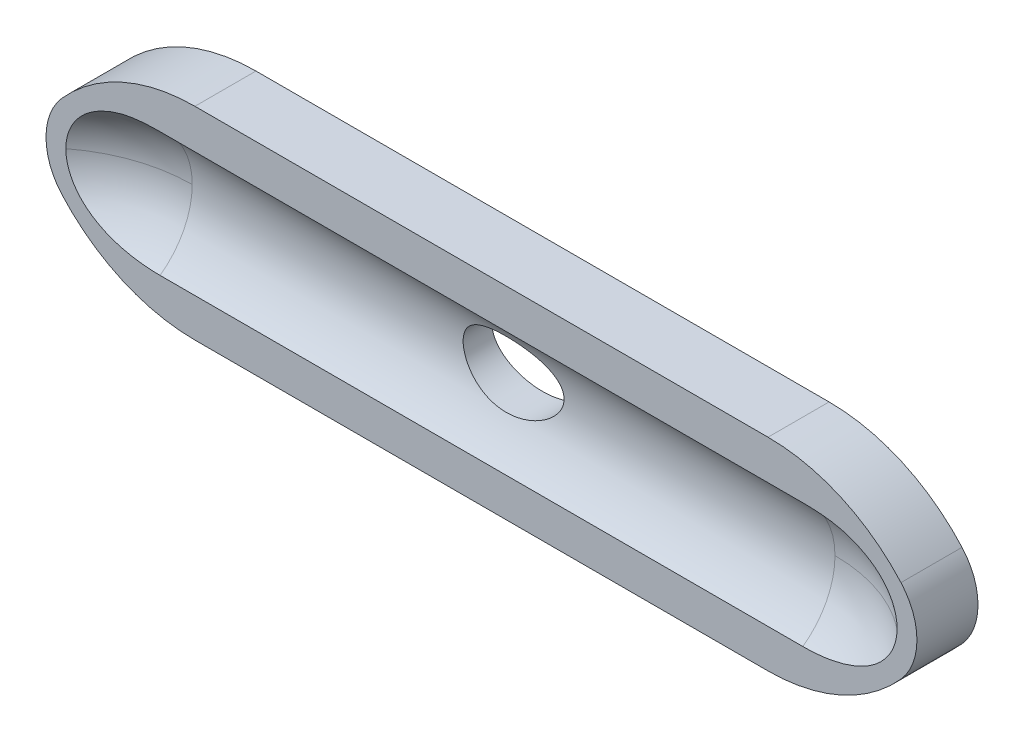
SolidWorks part; units mm, degrees
ref_plane "Front Plane" through (0, 0, 0) normal (0, 0, 1) x (1, 0, 0)
ref_plane "Top Plane" through (0, 0, 0) normal (0, 1, 0) x (1, 0, 0)
ref_plane "Right Plane" through (0, 0, 0) normal (1, 0, 0) x (0, 0, -1)
sketch "Sketch1" plane through (0, 0, 0) normal (0, 0, 1) x (1, 0, 0)
  line L17 (-22.2918, 27.0645) -> (22.2918, 27.0645)
  line L18 (22.2918, 42.8145) -> (-22.2918, 42.8145)
  line L19 (22.2918, 42.8145) -> (-22.2918, 42.8145)
  arc A45 (-32.6336, 31.6895) -> (-22.2918, 27.0645) centre (-22.2918, 40.9395) ccw
  arc A46 (-32.6336, 38.1895) -> (-32.6336, 31.6895) centre (-29, 34.9395) ccw
  arc A47 (-22.2918, 42.8145) -> (-32.6336, 38.1895) centre (-22.2918, 28.9395) ccw
  arc A48 (22.2918, 27.0645) -> (32.6336, 31.6895) centre (22.2918, 40.9395) ccw
  arc A49 (32.6336, 31.6895) -> (32.6336, 38.1895) centre (29, 34.9395) ccw
  arc A50 (32.6336, 38.1895) -> (22.2918, 42.8145) centre (22.2918, 28.9395) ccw
  arc A51 (-32.6336, 31.6895) -> (-22.2918, 27.0645) centre (-22.2918, 40.9395) ccw
  arc A52 (-32.6336, 38.1895) -> (-32.6336, 31.6895) centre (-29, 34.9395) ccw
  arc A53 (-22.2918, 42.8145) -> (-32.6336, 38.1895) centre (-22.2918, 28.9395) ccw
  arc A54 (22.2918, 27.0645) -> (32.6336, 31.6895) centre (22.2918, 40.9395) ccw
  arc A55 (32.6336, 31.6895) -> (32.6336, 38.1895) centre (29, 34.9395) ccw
  arc A56 (32.6336, 38.1895) -> (22.2918, 42.8145) centre (22.2918, 28.9395) ccw
  ellipse E0 centre (0, 34.9395) end of major axis (-3.925, 34.9395) minor radius 2.5625 construction
  ellipse E1 centre (0, 34.9395) end of major axis (-3.925, 34.9395) minor radius 2.5625
  dimension "D1" = 0.125
extrude "Boss-Extrude1" add sketch "Sketch1" against normal blind 4.75
other "Cavity1"
other "mock iphone<1>@charging stand assem1"
sketch "Sketch4" plane through (0, 0, 0) normal (1, 0, 0) x (0, 0, -1)
  line L0 (0, 30.0661) -> (0, 39.7479)
  arc A0 (0, 30.0661) -> (2.5, 34.9395) centre (-3.5, 34.9395) ccw construction
  arc A1 (2.5, 34.9395) -> (0.4686, 39.4395) centre (-3.5, 34.9395) ccw construction
  arc A2 (0.4686, 39.4395) -> (0, 39.7479) centre (-0.8542, 37.9395) ccw construction
  arc A3 (0, 30.0661) -> (2.5, 34.9395) centre (-3.5, 34.9395) ccw
  arc A4 (2.5, 34.9395) -> (0.4686, 39.4395) centre (-3.5, 34.9395) ccw
  arc A5 (0.4686, 39.4395) -> (0, 39.7479) centre (-0.8542, 37.9395) ccw
extrude "Cut-Extrude1" cut sketch "Sketch4" against normal mid plane 20
sketch "Sketch5" plane through (0, 0, -4.75) normal (0, 0, -1) x (-1, 0, 0)
  circle A0 centre (29, 34.9395) radius 10
  circle A1 centre (-29, 34.9395) radius 10
  dimension "D1" = 20
extrude "Boss-Extrude2" [suppressed] add sketch "Sketch5" against normal blind 0.35
sketch "Sketch6" [suppressed] plane through (0, 0, -4.4) normal (0, 0, 1) x (1, 0, 0)
  line L0 (-28.6657, 34.9395) -> (-38.6657, 34.9395)
  line L2 (-28.6657, 34.9395) -> (-35.7368, 27.8684)
  line L3 (-28.6657, 34.9395) -> (-35.7368, 42.0106)
  line L4 (-28.3122, 35.2931) -> (-35.3832, 42.3641)
  line L5 (-28.6657, 35.4395) -> (-38.6657, 35.4395)
  line L6 (-29.0193, 35.2931) -> (-36.0903, 28.222)
  line L7 (-29.0193, 34.5859) -> (-36.0903, 41.657)
  line L8 (-28.6657, 34.4395) -> (-38.6657, 34.4395)
  line L9 (-28.3122, 34.5859) -> (-35.3832, 27.5149)
  line L10 (-28.3122, 35.2931) -> (-29.0193, 34.5859)
  line L11 (-35.3832, 42.3641) -> (-36.0903, 41.657)
  line L12 (-28.6657, 35.4395) -> (-28.6657, 34.4395)
  line L13 (-38.6657, 35.4395) -> (-38.6657, 34.4395)
  line L14 (-29.0193, 35.2931) -> (-28.3122, 34.5859)
  line L15 (-36.0903, 28.222) -> (-35.3832, 27.5149)
  dimension "D1" = 45
  dimension "D2" = 45
  dimension "D3" = 10
  dimension "D4" = 0.5
  dimension "D5" = 0.5
extrude "Boss-Extrude3" [suppressed] add sketch "Sketch6" along normal blind 2 contours L7 L11 L4 L10 | L5 L13 L8 L12 | L6 L15 L9 L14
chamfer "Chamfer1" [suppressed] distance 1.5 angle 45
mirror "Mirror1" [suppressed] about plane through (0, 0, 0) normal (1, 0, 0)
